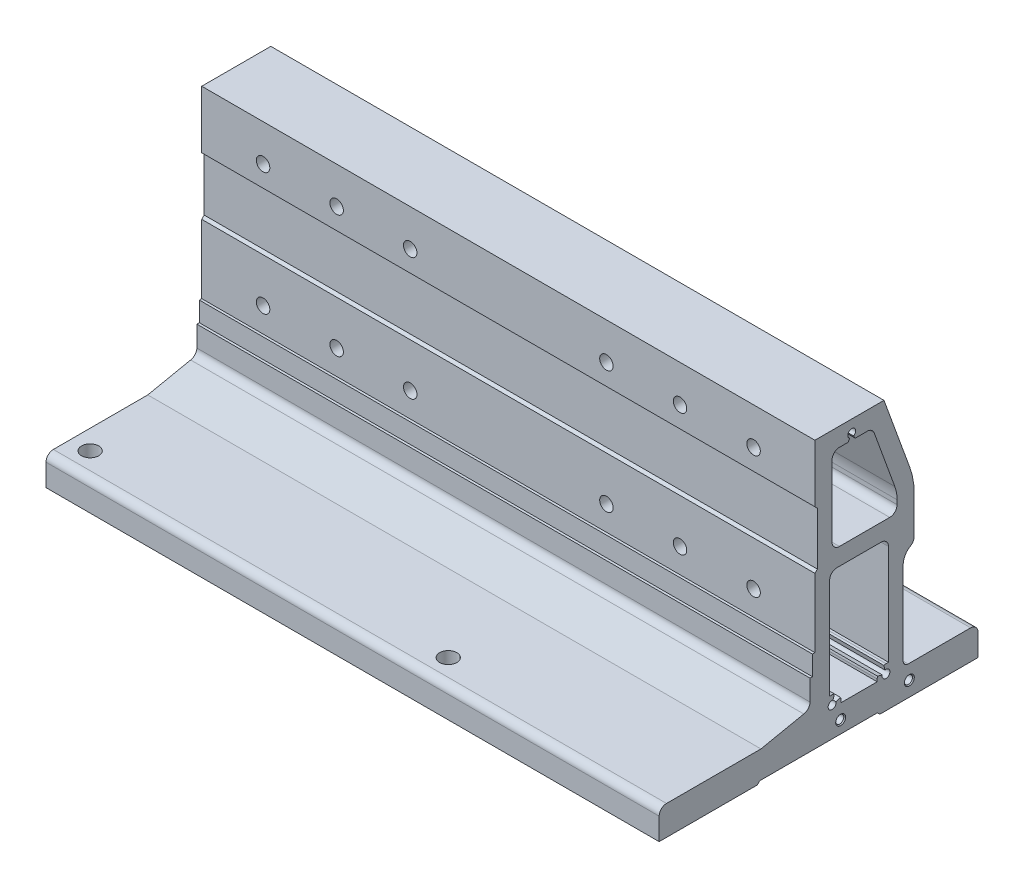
SolidWorks part; units mm, degrees
ref_plane "정면" through (0, 0, 0) normal (0, 0, 1) x (1, 0, 0)
ref_plane "윗면" through (0, 0, 0) normal (0, 1, 0) x (1, 0, 0)
ref_plane "우측면" through (0, 0, 0) normal (1, 0, 0) x (0, 0, -1)
sketch "스케치1" plane through (0, 0, 0) normal (1, 0, 0) x (0, 0, -1)
  line L0 (26.6655, 109) -> (-1.5, 109)
  line L1 (-1.5, 109) -> (-1.5, 85.5)
  line L2 (-1.5, 85.5) -> (-0.5, 84.5)
  line L3 (-0.5, 84.5) -> (-0.5, 63)
  line L4 (-0.5, 63) -> (-1.5, 62)
  line L5 (-1.5, 62) -> (-1.5, 34)
  line L6 (-1.5, 34) -> (-2.5, 34)
  line L7 (-2.5, 34) -> (-2.5, 26)
  line L8 (-2.5, 26) -> (-3.5, 26)
  line L9 (-3.5, 26) -> (-3.5, 17.5661)
  line L10 (-6.0351, 14.6023) -> (-23.5, 11)
  line L11 (-23.5, 11) -> (-62, 11)
  line L12 (-65, 8) -> (-65, -1)
  line L13 (-65, -1) -> (-25, -1)
  line L14 (-25, -1) -> (-24, 0)
  line L15 (-24, 0) -> (24, 0)
  line L16 (24, 0) -> (25, -1)
  line L17 (25, -1) -> (65, -1)
  line L18 (65, -1) -> (65, 8)
  line L19 (62, 11) -> (36.5, 11)
  line L20 (34.5, 13) -> (34.5, 47)
  line L21 (39, 54.7942) -> (39, 69.8213)
  line L22 (37.1908, 80.0819) -> (26.6655, 109)
  line L23 (25.5, 59.5) -> (7.5, 59.5)
  line L24 (4.5, 56.5) -> (4.5, 15.6)
  line L25 (4.5, 15.6) -> (5.5, 15.6)
  line L26 (6.4317, 15.4773) -> (5.9141, 13.5455)
  line L27 (7.0455, 12.4141) -> (8.9773, 12.9317)
  line L28 (9.1, 12) -> (9.1, 11)
  line L29 (9.1, 11) -> (23.9, 11)
  line L30 (23.9, 11) -> (23.9, 12)
  line L31 (24.0227, 12.9317) -> (25.9545, 12.4141)
  line L32 (27.0859, 13.5455) -> (26.5683, 15.4773)
  line L33 (27.5, 15.6) -> (28.5, 15.6)
  line L34 (28.5, 15.6) -> (28.5, 56.5)
  line L35 (12.7, 102.6144) -> (12.0566, 101.5)
  line L36 (12.0566, 101.5) -> (8.5, 101.5)
  line L37 (5.5, 98.5) -> (5.5, 69.5)
  line L38 (8.5, 66.5) -> (29, 66.5)
  line L39 (32, 69.5) -> (32, 71.2319)
  line L40 (31.0954, 76.3622) -> (22.6644, 99.5261)
  line L41 (19.8454, 101.5) -> (14.9434, 101.5)
  line L42 (14.9434, 101.5) -> (14.3, 102.6144)
  arc A0 (-6.0351, 14.6023) -> (-3.5, 17.5661) centre (-6.5, 17.5661) ccw
  arc A1 (-62, 11) -> (-65, 8) centre (-62, 8) ccw
  arc A2 (65, 8) -> (62, 11) centre (62, 8) ccw
  arc A3 (34.5, 13) -> (36.5, 11) centre (36.5, 13) ccw
  arc A4 (37.5, 52.1962) -> (34.5, 47) centre (40.5, 47) ccw
  arc A5 (37.5, 52.1962) -> (39, 54.7942) centre (36, 54.7942) ccw
  arc A6 (39, 69.8213) -> (37.1908, 80.0819) centre (9, 69.8213) ccw
  arc A7 (7.5, 59.5) -> (4.5, 56.5) centre (7.5, 56.5) ccw
  arc A8 (6.4317, 15.4773) -> (5.5, 15.6) centre (5.5, 12) ccw
  arc A9 (5.9141, 13.5455) -> (7.0455, 12.4141) centre (5.5, 12) ccw
  arc A10 (9.1, 12) -> (8.9773, 12.9317) centre (5.5, 12) ccw
  arc A11 (24.0227, 12.9317) -> (23.9, 12) centre (27.5, 12) ccw
  arc A12 (25.9545, 12.4141) -> (27.0859, 13.5455) centre (27.5, 12) ccw
  arc A13 (27.5, 15.6) -> (26.5683, 15.4773) centre (27.5, 12) ccw
  arc A14 (28.5, 56.5) -> (25.5, 59.5) centre (25.5, 56.5) ccw
  arc A15 (14.3, 102.6144) -> (12.7, 102.6144) centre (13.5, 104) ccw
  arc A16 (8.5, 101.5) -> (5.5, 98.5) centre (8.5, 98.5) ccw
  arc A17 (5.5, 69.5) -> (8.5, 66.5) centre (8.5, 69.5) ccw
  arc A18 (29, 66.5) -> (32, 69.5) centre (29, 69.5) ccw
  arc A19 (32, 71.2319) -> (31.0954, 76.3622) centre (17, 71.2319) ccw
  arc A20 (22.6644, 99.5261) -> (19.8454, 101.5) centre (19.8454, 98.5) ccw
extrude "보스-돌출1" add sketch "스케치1" along normal mid plane 250
hole_wizard "M5 소켓 머리 캡 나사용 카운터보어1" positions "스케치2" profile "스케치3" counterbore size "M5" standard "KS"
sketch "스케치2" plane through (0, 0, -39) normal (0, 0, -1) x (-1, 0, 0)
  line L0 (-125, 80.0819) -> (-125, 109) construction
  line L1 (-125, -1) -> (125, -1) construction
  point P0 (-100, 94)
  point P2 (-70, 94)
  point P4 (-40, 94)
  point P6 (-100, 44)
  point P8 (-70, 44)
  point P10 (-40, 44)
  dimension "D1" = 25
  dimension "D2" = 30
  dimension "D3" = 30
  dimension "D4" = 45
  dimension "D5" = 50
sketch "스케치3" plane through (100, 94, -39) normal (1, 0, 0) x (0, 1, 0)
  line L0 (0, 0) -> (0, 104)
  line L1 (0, 104) -> (2.75, 104)
  line L3 (2.75, 104) -> (2.75, 34.5)
  line L4 (2.75, 34.5) -> (4.75, 34.5)
  line L5 (4.75, 34.5) -> (4.75, 0)
  line L7 (4.75, 0) -> (0, 0)
  line L11 (0, -6.35) -> (0, 107.95) construction
  dimension "관통 구멍 지름" = 5.5
  dimension "관통 구멍 깊이" = 104
  dimension "카운터보어 지름" = 9.5
  dimension "카운터보어 깊이" = 34.5
hole_wizard "M4 나사 구멍1" positions "스케치4" profile "스케치5" tap size "M4" standard "ISO"
sketch "스케치4" plane through (125, 0, 0) normal (1, 0, 0) x (0, 0, -1)
  line L0 (65, -1) -> (65, 8) construction
  line L1 (25, -1) -> (65, -1) construction
  point P0 (9, 5)
  point P2 (37, 5)
  dimension "D1" = 28
  dimension "D2" = 28
  dimension "D3" = 6
sketch "스케치5" plane through (125, 5, -9) normal (0, 1, 0) x (0, 0, -1)
  line L0 (0, 0) -> (0, 10.9914)
  line L1 (0, 10.9914) -> (1.65, 10)
  line L2 (1.65, 10) -> (1.65, 0.375)
  line L3 (1.65, 0.375) -> (2.025, 0)
  line L5 (2.025, 0) -> (0, 0)
  line L6 (-1.65, 0.375) -> (-2.025, 0) construction
  line L10 (0, 10.9914) -> (-1.65, 10) construction
  line L11 (0, -6.35) -> (0, 107.95) construction
  dimension "탭 드릴 지름" = 3.3
  dimension "탭 드릴 깊이" = 10
  dimension "표면 카운터싱크 지름" = 4.05
  dimension "표면 카운터싱크 각도" = 90
  dimension "드릴 각도" = 118
hole_wizard "Ø5.0mm 맞춤핀 구멍1" positions "스케치6" profile "스케치7" hole size "Ø5.0" standard "ISO"
sketch "스케치6" plane through (0, 0, 0) normal (0, -1, 0) x (-1, 0, 0)
  line L0 (0, 0) -> (147.294, 0) construction
  line L1 (125, -24) -> (125, 24) construction
  point P6 (117, 0)
  point P8 (-29, 0)
  dimension "D1" = 146
  dimension "D2" = 8
sketch "스케치7" plane through (29, 0, 0) normal (1, 0, 0) x (0, 0, -1)
  line L0 (0, 0) -> (0, 11.5022)
  line L1 (0, 11.5022) -> (2.5, 10)
  line L2 (2.5, 10) -> (2.5, 0)
  line L5 (2.5, 0) -> (0, 0)
  line L10 (0, 11.5022) -> (-2.5, 10) construction
  line L11 (0, -6.35) -> (0, 107.95) construction
  dimension "구멍 지름" = 5
  dimension "구멍 깊이" = 10
  dimension "드릴 각도" = 118
hole_wizard "Ø7.0 (7) 지름 구멍1" positions "스케치8" profile "스케치9" hole size "Ø7.0" standard "ISO"
sketch "스케치8" plane through (0, -1, 0) normal (0, -1, 0) x (-1, 0, 0)
  line L0 (125, -65) -> (125, -25) construction
  line L1 (-125, 65) -> (125, 65) construction
  point P0 (117, -55)
  point P2 (-29, -55)
  point P4 (117, 55)
  point P6 (-29, 55)
  dimension "D1" = 8
  dimension "D2" = 146
  dimension "D3" = 10
  dimension "D4" = 110
sketch "스케치9" plane through (-117, -1, 55) normal (1, 0, 0) x (0, 0, -1)
  line L0 (0, 0) -> (0, 110)
  line L1 (0, 110) -> (3.5, 110)
  line L2 (3.5, 110) -> (3.5, 0)
  line L5 (3.5, 0) -> (0, 0)
  line L11 (0, -6.35) -> (0, 107.95) construction
  dimension "관통 구멍 지름" = 7
  dimension "관통 구멍 깊이" = 110
pattern_linear "선형 패턴1" count 2 spacing 140 along (-1, 0, 0) of "M5 소켓 머리 캡 나사용 카운터보어1"
